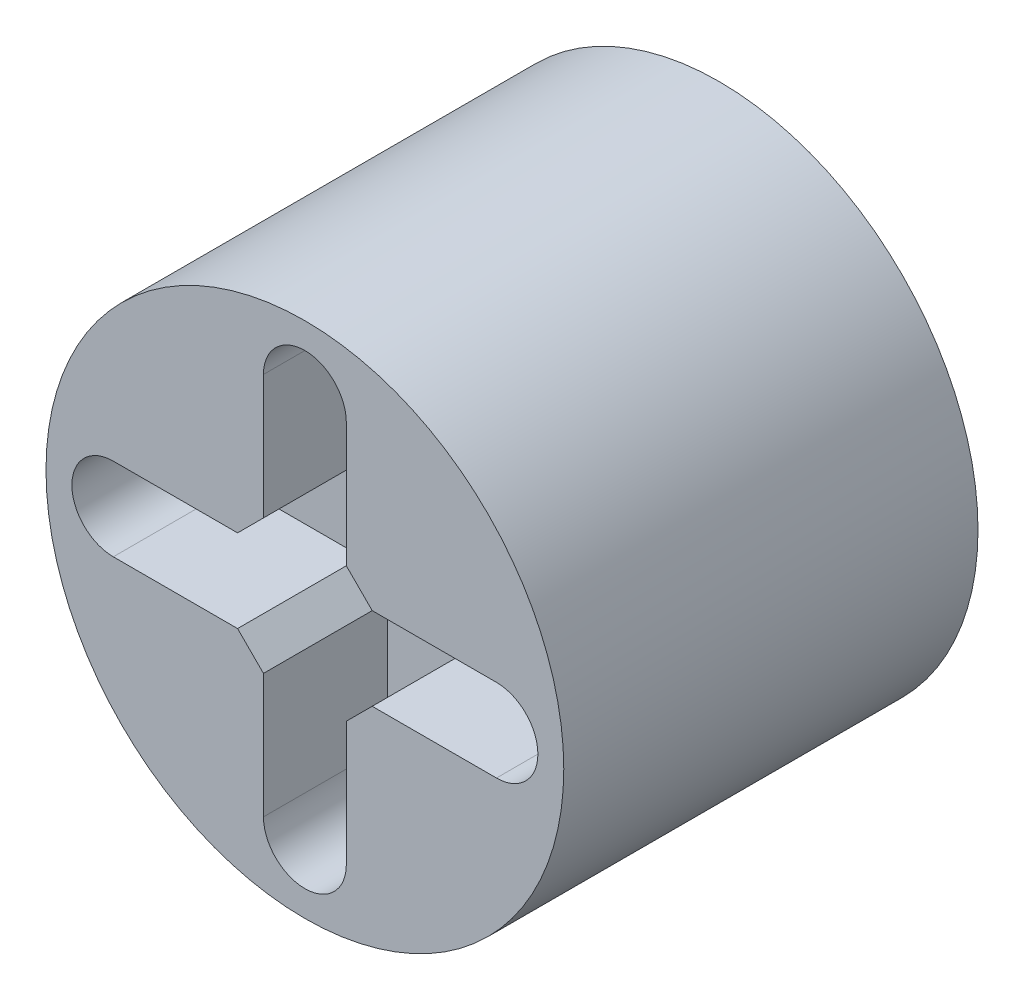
SolidWorks part; units mm, degrees
ref_plane "Front Plane" through (0, 0, 0) normal (0, 0, 1) x (1, 0, 0)
ref_plane "Top Plane" through (0, 0, 0) normal (0, 1, 0) x (1, 0, 0)
ref_plane "Right Plane" through (0, 0, 0) normal (1, 0, 0) x (0, 0, -1)
sketch "Sketch1" plane through (0, 0, 0) normal (0, 0, 1) x (1, 0, 0)
  line L1 (5, 5) -> (-5, 5)
  line L2 (5, 5) -> (5, -5)
  line L3 (5, -5) -> (-5, -5)
  line L4 (-5, 5) -> (-5, -5)
  line L5 (5, 5) -> (-5, -5) construction
  line L6 (5, -5) -> (-5, 5) construction
  circle A1 centre (0, 0) radius 12.5
  dimension "D1" = 10
  dimension "D2" = 25
extrude "Boss-Extrude1" add sketch "Sketch1" along normal blind 10
sketch "Sketch2" plane through (0, 0, 10) normal (0, 0, 1) x (1, 0, 0)
  circle A0 centre (0, 0) radius 12.5
  point P10 (-12.5, 0)
extrude "Boss-Extrude2" add sketch "Sketch2" along normal blind 10
sketch "Sketch5" plane through (0, 0, 20) normal (0, 0, 1) x (1, 0, 0)
  line L28 (0, 12.5) -> (0, -12.5) construction
  line L29 (-12.5, 0) -> (12.5, 0) construction
  line L30 (-9.25, 2) -> (-2, 2)
  line L35 (-9.25, -2) -> (-2, -2)
  line L36 (-2, 9.25) -> (-2, 2)
  line L37 (2, 9.25) -> (2, 2)
  line L38 (-2, -2) -> (-2, -9.25)
  line L39 (2, 2) -> (9.25, 2)
  line L40 (2, -2) -> (9.25, -2)
  line L41 (2, -2) -> (2, -9.25)
  line L42 (-2, 2) -> (-2, -2) construction
  line L43 (2, -2) -> (-2, -2) construction
  line L44 (-2, 2) -> (2, 2) construction
  line L45 (2, -2) -> (2, 2) construction
  line L99 (-2, 2) -> (0, 0) construction
  line L100 (0, 0) -> (2, -2) construction
  circle A21 centre (0, 0) radius 12.5 construction
  arc A22 (-9.25, 2) -> (-9.25, -2) centre (-9.25, 0) ccw
  arc A23 (-2, -9.25) -> (2, -9.25) centre (0, -9.25) ccw
  arc A24 (-2, 9.25) -> (2, 9.25) centre (0, 9.25) cw
  arc A25 (9.25, 2) -> (9.25, -2) centre (9.25, 0) cw
  circle A31 centre (-6.25, 0) radius 0.5
  circle A46 centre (-4.25, 0) radius 0.5
  circle A47 centre (-8.25, 0) radius 0.5
  circle A48 centre (0, 8.25) radius 0.5
  circle A49 centre (0, 6.25) radius 0.5
  circle A50 centre (0, 4.25) radius 0.5
  circle A51 centre (8.25, 0) radius 0.5
  circle A52 centre (6.25, 0) radius 0.5
  circle A53 centre (4.25, 0) radius 0.5
  circle A54 centre (0, -8.25) radius 0.5
  circle A55 centre (0, -6.25) radius 0.5
  circle A56 centre (0, -4.25) radius 0.5
  point P97 (-11.25, 0)
  point P98 (11.25, 0)
  point P128 (0, 0)
  dimension "D4" = 22.5
  dimension "D6" = 1
  dimension "D5" = 4
  dimension "D7" = 2
  dimension "D8" = 2
  dimension "D9" = 2.25
  dimension "D10" = 4
extrude "Cut-Extrude2" cut sketch "Sketch5" against normal blind 6 contours A25 L39 L37 A24 L36 L30 A22 L35 L38 A23 L41 L40 A56 A55 A54 A53 A52 A51 A50 A49 A48 A47 A46 A31 | A47 | A46 | A48 | A53 | A52 | A51 | A56 | A55 | A54
chamfer "Chamfer1" distance 1.25 angle 45 4 edges at (-2, -2, 17) (2, -2, 17) (2, 2, 17) (-2, 2, 17)
